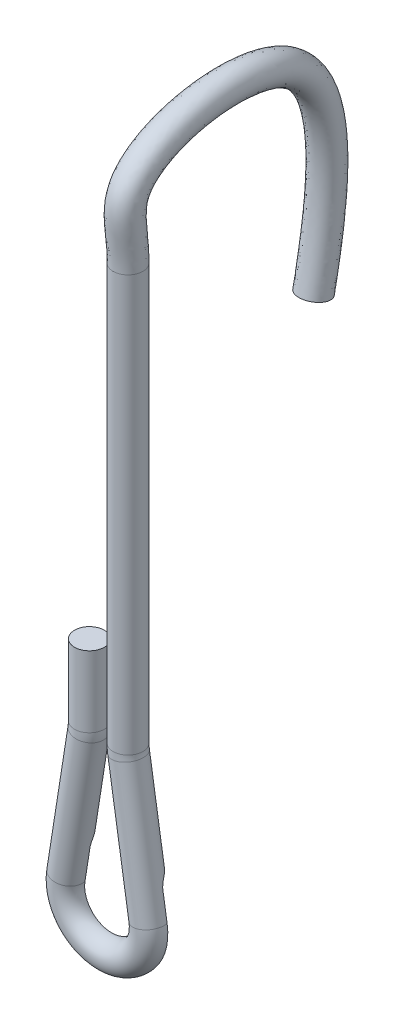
SolidWorks part; units mm, degrees
ref_plane "Plan de face" through (0, 0, 0) normal (0, 0, 1) x (1, 0, 0)
ref_plane "Plan de dessus" through (0, 0, 0) normal (0, 1, 0) x (1, 0, 0)
ref_plane "Plan de droite" through (0, 0, 0) normal (1, 0, 0) x (0, 0, -1)
sketch "Esquisse2" plane through (0, 0, 0) normal (1, 0, 0) x (0, 0, -1)
  line L3 (-803.9122, 2093.6116) -> (-803.9122, 2033.6116)
  spline S0 degree 3 poles (-803.9122, 2093.6116) (-803.9122, 2097.8855) (-807.529, 2109.1272) (-764.5102, 2117.617) (-770.5972, 2084.3643) (-772.6903, 2073.6749) knots 0 0 0 0 0.134698 0.501468 1 1 1 1
  dimension "D3" = 60
ref_plane "Plan4" through (0, 2033.6116, 0) normal (0, 1, 0) x (-1, 0, 0)
sketch "Esquisse3" plane through (0, 2033.6116, 0) normal (0, 1, 0) x (-1, 0, 0)
  circle A0 centre (0, 803.9122) radius 2.5
  dimension "D1" = 5
sweep "Balayage3" add profiles "Esquisse3" path "Esquisse2"
ref_plane "Plan5" through (0, 0, 803.9122) normal (0, 0, 1) x (1, 0, 0)
sketch "Esquisse5" plane through (0, 0, 803.9122) normal (0, 0, 1) x (1, 0, 0)
  line L0 (-6.5973, 2022.3678) -> (-10.1649, 1999.6999)
  line L1 (-3.25, 2027.4469) -> (-3.25, 1987.5811) construction
  line L2 (0.0973, 2022.3678) -> (3.6649, 1999.6999)
  line L3 (0, 2023.6116) -> (0, 2033.6116)
  line L5 (-6.5, 2023.6116) -> (-6.5, 2035.5654)
  line L6 (2.75, 2033.6116) -> (-2.75, 2033.6116) construction
  arc A1 (-6.5973, 2022.3678) -> (-6.5, 2023.6116) centre (-14.5, 2023.6116) ccw
  arc A2 (0.0973, 2022.3678) -> (0, 2023.6116) centre (8, 2023.6116) cw
  arc A3 (-10.1649, 1999.6999) -> (3.6649, 1999.6999) centre (-3.25, 1998.6116) ccw
  dimension "D1" = 3.25
  dimension "D2" = 8
  dimension "D6" = 7
  dimension "D4" = 10
  dimension "D5" = 35
sketch "Esquisse6" plane through (0, 2033.6116, 0) normal (0, 1, 0) x (-1, 0, 0)
  circle A0 centre (0, 803.9122) radius 2.5
sweep "Balayage4" add profiles "Esquisse6" path "Esquisse5"
sketch "Esquisse7" plane through (0, 0, 0) normal (1, 0, 0) x (0, 0, -1)
  line L1 (-808.4133, 1998.6116) -> (-794.9101, 1998.6116) construction
  line L5 (-803.9122, 2005.408) -> (-803.9122, 1987.9378) construction
  line L6 (-803.9122, 1999.6999) -> (-803.9122, 2022.3678) construction
  line L7 (-798.4122, 1990.6116) -> (-801.4122, 1990.6116)
  line L8 (-803.4122, 2004.6116) -> (-803.4122, 1992.6116)
  line L11 (-798.4122, 2006.6116) -> (-798.4122, 1990.6116)
  line L12 (-798.4122, 2006.6116) -> (-801.4122, 2006.6116)
  arc A0 (-801.4122, 1990.6116) -> (-803.4122, 1992.6116) centre (-801.4122, 1992.6116) cw
  arc A1 (-803.4122, 2004.6116) -> (-801.4122, 2006.6116) centre (-801.4122, 2004.6116) cw
  point P11 (-803.4122, 2006.6116)
  dimension "D5" = 2
  dimension "D1" = 1
  dimension "D2" = 5
  dimension "D3" = 8
  dimension "D4" = 8
extrude "Enlèv. mat.-Extru.1" cut sketch "Esquisse7" against normal through all and the other way through all
